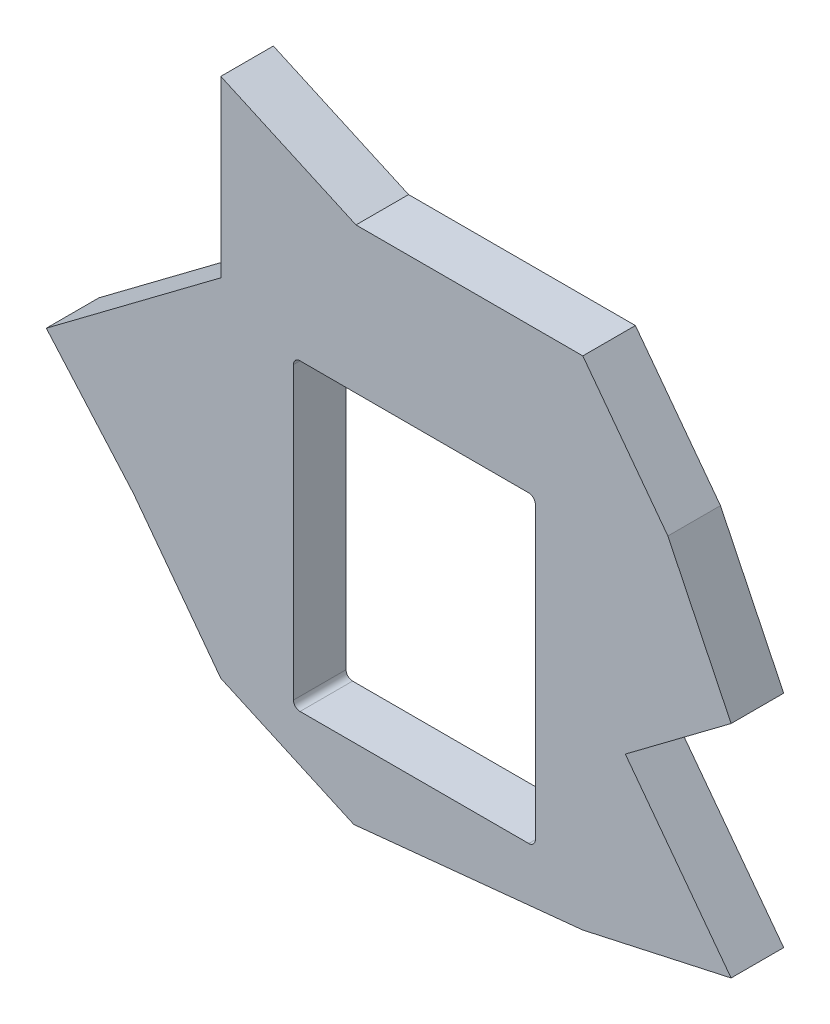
SolidWorks part; units mm, degrees
ref_plane "Plan de face" through (0, 0, 0) normal (0, 0, 1) x (1, 0, 0)
ref_plane "Plan de dessus" through (0, 0, 0) normal (0, 1, 0) x (1, 0, 0)
ref_plane "Plan de droite" through (0, 0, 0) normal (1, 0, 0) x (0, 0, -1)
sketch "Esquisse1" plane through (0, 0, 0) normal (0, 0, 1) x (1, 0, 0)
  line L1 (303.915, -173.8595) -> (-396.085, -173.8595)
  line L2 (303.915, -173.8595) -> (303.915, 1716.1405)
  line L3 (303.915, 1716.1405) -> (-396.085, 1716.1405)
  line L4 (-396.085, -173.8595) -> (-396.085, 1716.1405)
  line L12 (-92, 106.15) -> (-92, -114.85)
  line L13 (87, 111.15) -> (-87, 111.15)
  line L14 (92, -114.85) -> (92, 106.15)
  line L15 (-87, -119.85) -> (87, -119.85)
  line L16 (-92, 106.15) -> (-92, -114.85)
  line L17 (87, 111.15) -> (-87, 111.15)
  line L18 (92, -114.85) -> (92, 106.15)
  line L19 (-87, -119.85) -> (87, -119.85)
  arc A8 (-92, -114.85) -> (-87, -119.85) centre (-87, -114.85) ccw
  arc A9 (-87, 111.15) -> (-92, 106.15) centre (-87, 106.15) ccw
  arc A10 (92, 106.15) -> (87, 111.15) centre (87, 106.15) ccw
  arc A11 (87, -119.85) -> (92, -114.85) centre (87, -114.85) ccw
  arc A12 (-92, -114.85) -> (-87, -119.85) centre (-87, -114.85) ccw
  arc A13 (-87, 111.15) -> (-92, 106.15) centre (-87, 106.15) ccw
  arc A14 (92, 106.15) -> (87, 111.15) centre (87, 106.15) ccw
  arc A15 (87, -119.85) -> (92, -114.85) centre (87, -114.85) ccw
  dimension "D1" = 700
  dimension "D2" = 1890
  dimension "D3" = 5
extrude "Extrusion1" add sketch "Esquisse1" along normal blind 40
sketch "Esquisse2" plane through (0, 0, 0) normal (0, 0, -1) x (-1, 0, 0)
  line L0 (280.0216, 36.148) -> (147.2916, 135.6955)
  line L1 (147.2916, 135.6955) -> (147.2916, 268.4255)
  line L2 (147.2916, 268.4255) -> (44.4258, 221.97)
  line L3 (44.4258, 221.97) -> (-128.1232, 221.97)
  line L4 (-128.1232, 221.97) -> (-192.8291, 135.6955)
  line L5 (-192.8291, 135.6955) -> (-240.9437, 36.148)
  line L6 (-240.9437, 36.148) -> (-160.4761, -24.2027)
  line L7 (-160.4761, -24.2027) -> (-240.9437, -131.4928)
  line L8 (-240.9437, -131.4928) -> (-128.1232, -156.3105)
  line L9 (-128.1232, -156.3105) -> (46.085, -173.8595)
  line L10 (396.085, -173.8595) -> (-303.915, -173.8595) construction
  line L11 (46.085, -173.8595) -> (147.2916, -128.1533)
  line L12 (147.2916, -128.1533) -> (213.6566, -39.6666)
  line L13 (213.6566, -39.6666) -> (280.0216, 36.148)
extrude "Enlèv. mat.-Extru.1" cut sketch "Esquisse2" against normal through all flip side to cut
